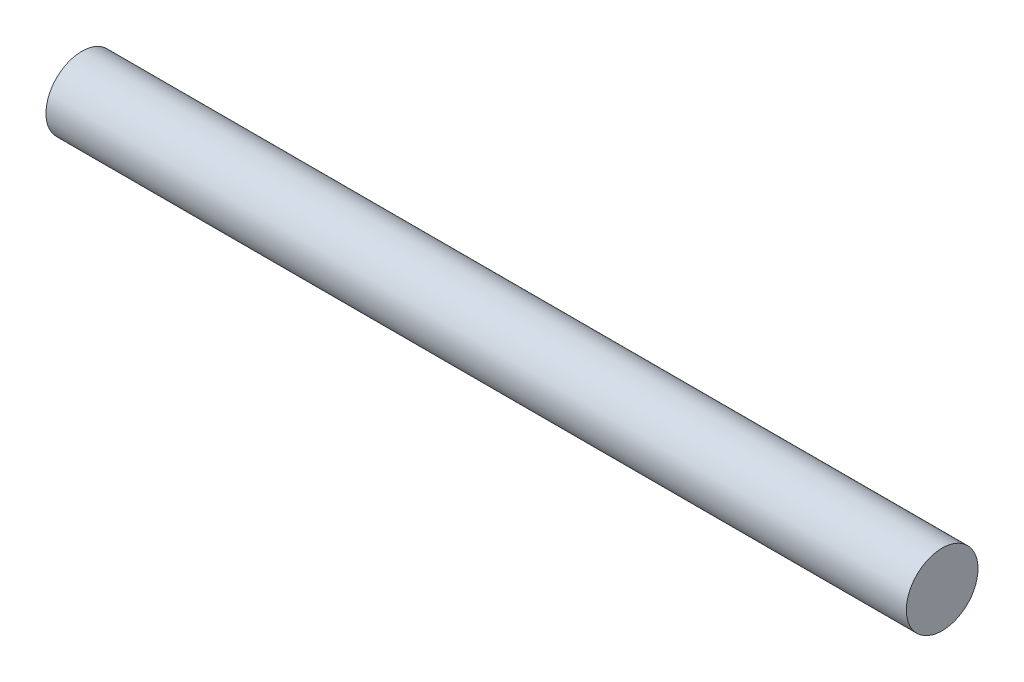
SolidWorks part; units mm, degrees
ref_plane "Front Plane" through (0, 0, 0) normal (1, 0, 0) x (0, 1, 0)
ref_plane "Top Plane" through (0, 0, 0) normal (0, 0, 1) x (0, 1, 0)
ref_plane "Right Plane" through (0, 0, 0) normal (0, 1, 0) x (-1, 0, 0)
sketch "Sketch1" plane through (0, 0, 0) normal (1, 0, 0) x (0, 1, 0)
  circle A0 centre (0, 0) radius 3
  dimension "D1" = 6
extrude "Boss-Extrude1" add sketch "Sketch1" along normal blind 72
